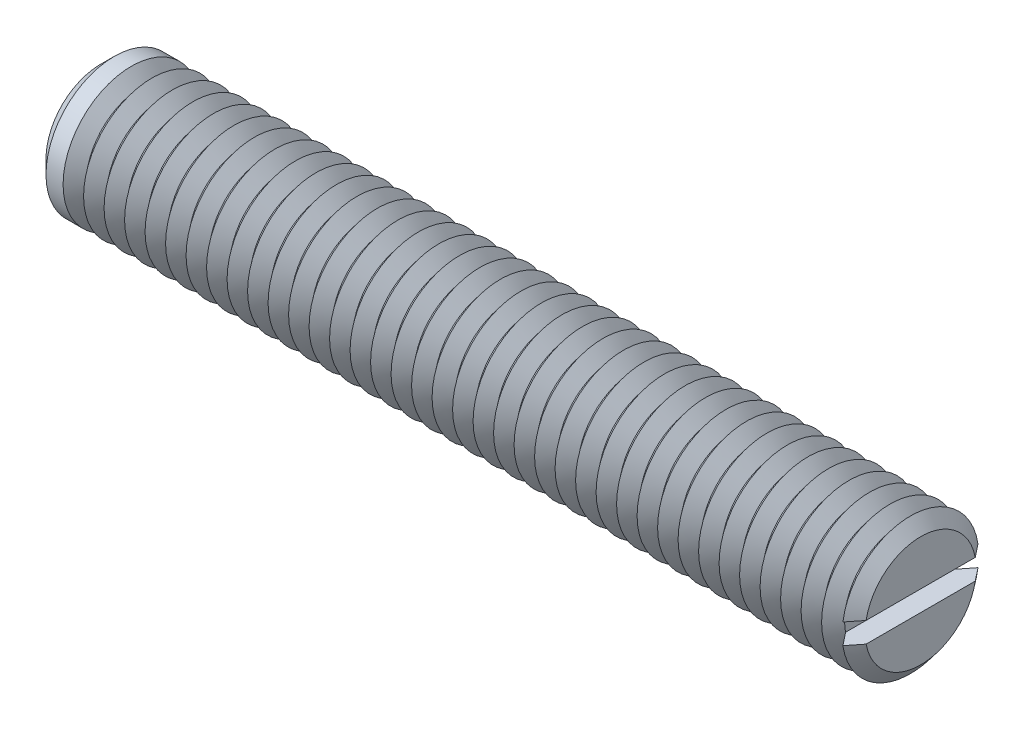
SolidWorks part; units mm, degrees
ref_plane "Front Plane" through (0, 0, 0) normal (0, 0, 1) x (1, 0, 0)
ref_plane "Top Plane" through (0, 0, 0) normal (0, 1, 0) x (1, 0, 0)
ref_plane "Right Plane" through (0, 0, 0) normal (1, 0, 0) x (0, 0, -1)
sketch "Sketch1" plane through (0, 0, 0) normal (1, 0, 0) x (0, 0, -1)
  circle A0 centre (0, 0) radius 5
  dimension "D1" = 10
extrude "Extrude1" add sketch "Sketch1" along normal mid plane 60
sketch "Sketch2" plane through (0, 0, 0) normal (0, 0, 1) x (1, 0, 0)
  line L0 (30, 0.75) -> (28.5, 0.75)
  line L1 (30, -5) -> (30, 5) construction
  line L2 (28.5, 0.75) -> (28.5, -0.75)
  line L3 (0, 0) -> (50000, 0) construction
  line L4 (30, -0.75) -> (28.5, -0.75)
  line L5 (30, -0.75) -> (30, 0.75)
  point P9 (28.5, 0)
  dimension "D1" = 1.5
extrude "Extrude2" cut sketch "Sketch2" against normal mid plane 15
chamfer "Chamfer1" distance 1 angle 45 1 edges at (-30, 0, -5)
sketch "Sketch3" plane through (0, 0, 0) normal (0, 0, 1) x (1, 0, 0)
  line L0 (0, 0) -> (30.9602, 0) construction
  line L1 (29.25, -5) -> (30.75, -5)
  line L2 (-29, -5) -> (30, -5) construction
  line L3 (30.75, -5) -> (30, -4.0633)
  line L4 (30, -5) -> (30, -0.75) construction
  line L5 (30, -4.0633) -> (29.25, -5)
  dimension "D1" = 1.5
  dimension "D2" = 1.2
revolve "Cut-Revolve1" cut sketch "Sketch3" angle 360 about L0
pattern_linear "LPattern1" count 39 spacing 1.5 along (-1, 0, 0) of "Cut-Revolve1"
equation "\"D2@Sketch3\" = \"D1@Sketch3\"*0.8"
